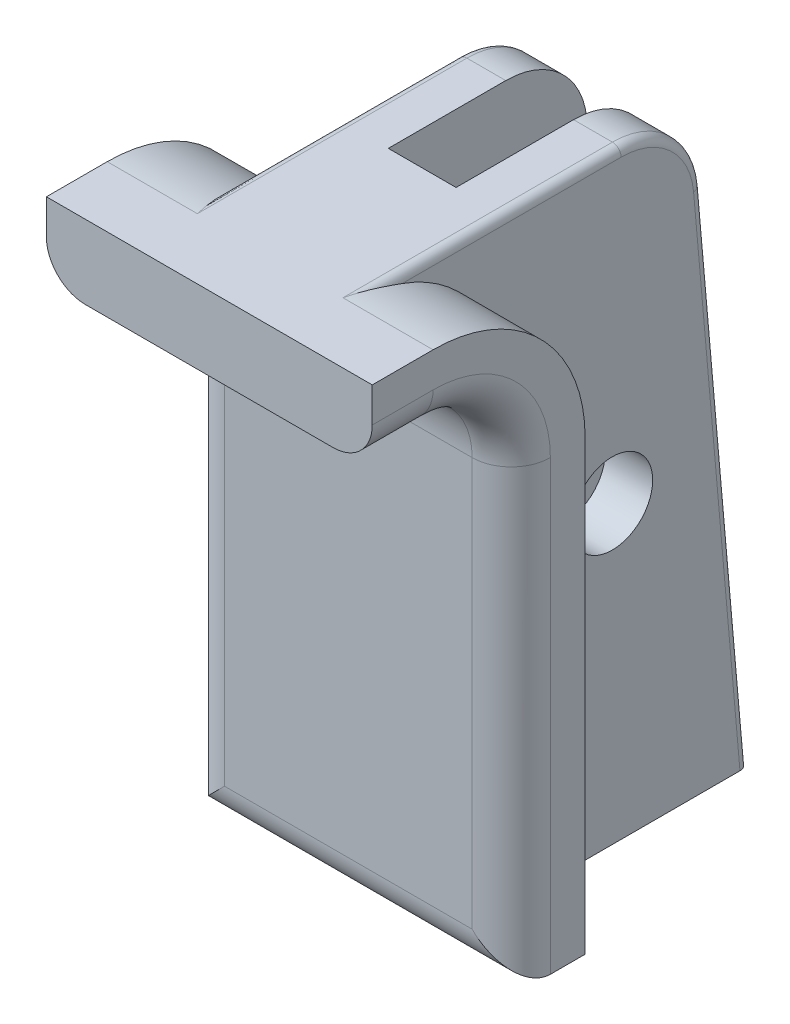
SolidWorks part; units mm, degrees
ref_plane "Front Plane" through (0, 0, 0) normal (0, 0, 1) x (1, 0, 0)
ref_plane "Top Plane" through (0, 0, 0) normal (0, 1, 0) x (1, 0, 0)
ref_plane "Right Plane" through (0, 0, 0) normal (1, 0, 0) x (0, 0, -1)
sketch "Sketch1" plane through (0, 0, 0) normal (1, 0, 0) x (0, 0, -1)
  line L0 (0, 0) -> (0, 17.526)
  line L1 (0, 0) -> (7.1628, 0)
  line L2 (5.8054, 15.3544) -> (7.1628, 0)
  line L3 (3.4334, 17.526) -> (0, 17.526)
  arc A0 (5.8054, 15.3544) -> (3.4334, 17.526) centre (3.4334, 15.1447) ccw
  point P7 (5.6134, 17.526)
  dimension "D4" = 2.3813
  dimension "D1" = 7.1628
  dimension "D2" = 17.526
  dimension "D3" = 5.6134
extrude "Boss-Extrude1" add sketch "Sketch1" along normal mid plane 4.7625
sketch "Sketch2" plane through (0, 0, 0) normal (1, 0, 0) x (0, 0, -1)
  line L0 (0, 17.526) -> (0, 0) construction
  line L1 (0, 13.081) -> (0, 0)
  line L2 (-2.159, 13.081) -> (-2.159, 0)
  line L3 (-2.159, 0) -> (0, 0)
  line L4 (-4.445, 17.526) -> (-6.223, 17.526)
  line L5 (-2.159, 17.526) -> (-2.159, 0) construction
  line L6 (-4.445, 15.367) -> (-6.223, 15.367)
  line L7 (0, 15.367) -> (-6.223, 15.367) construction
  line L8 (0, 17.526) -> (0, 0) construction
  line L9 (0, 17.526) -> (-6.223, 17.526) construction
  line L10 (-6.223, 17.526) -> (-6.223, 15.367)
  arc A0 (-2.159, 13.081) -> (-4.445, 15.367) centre (-4.445, 13.081) ccw
  arc A1 (0, 13.081) -> (-4.445, 17.526) centre (-4.445, 13.081) ccw
  dimension "D3" = 2.286
  dimension "D4" = 4.445
  dimension "D5" = 6.223
  dimension "D1" = 2.159
  dimension "D2" = 2.159
extrude "Boss-Extrude2" add sketch "Sketch2" along normal mid plane 9.525
sketch "Sketch3" plane through (0, 0, 0) normal (1, 0, 0) x (0, 0, -1)
  line L0 (0, 17.526) -> (0, 13.081) construction
  line L1 (0, 17.526) -> (0, 13.081)
  line L2 (0, 17.526) -> (-4.445, 17.526)
  arc A0 (0, 13.081) -> (-4.445, 17.526) centre (-4.445, 13.081) ccw construction
  arc A1 (0, 13.081) -> (-4.445, 17.526) centre (-4.445, 13.081) ccw
extrude "Boss-Extrude3" add sketch "Sketch3" along normal up to surface and the other way up to surface
fillet "Fillet1" radius 1.143 7 edges at (-4.7625, 15.367, 5.334) (-4.7625, 14.6974, 2.8286) (-4.7625, 6.5405, 2.159) (4.7625, 15.367, 5.334) (4.7625, 14.6974, 2.8286) (4.7625, 6.5405, 2.159) (0, 0, 2.159)
fillet "Fillet2" radius 0.254 6 edges at (-2.3813, 7.6772, -6.4841) (-2.3813, 16.9011, -5.0413) (2.3813, 7.6772, -6.4841) (2.3813, 16.9011, -5.0413) (-2.3812, 17.526, 0.5058) (2.3812, 17.526, 0.5058)
sketch "Sketch4" plane through (0, 0, 0) normal (0, -1, 0) x (1, 0, 0)
  line L0 (0, 0) -> (0, -13.5107) construction
  line L1 (-2.3812, 0) -> (-4.7625, 0) construction
  line L2 (0.9906, -10.4447) -> (-0.9906, -10.4447)
  line L3 (0.9906, -10.4447) -> (0.9906, 0)
  line L4 (0.9906, 0) -> (-0.9906, 0)
  line L5 (-0.9906, -10.4447) -> (-0.9906, 0)
  line L6 (0.9906, -10.4447) -> (-0.9906, 0) construction
  line L7 (0.9906, 0) -> (-0.9906, -10.4447) construction
  point P3 (0, -5.2224)
  dimension "D1" = 1.9812
extrude "Cut-Extrude1" cut sketch "Sketch4" against normal through all
sketch "Sketch5" plane through (2.3813, 0, 0) normal (1, 0, 0) x (0, 0, -1)
  line L0 (-4.445, 17.526) -> (3.4334, 17.526) construction
  line L1 (0, 17.526) -> (0, 0) construction
  circle A0 centre (3.175, 8.636) radius 1.1811
  dimension "D1" = 2.3622
  dimension "D2" = 8.89
  dimension "D3" = 3.175
extrude "Cut-Extrude2" cut sketch "Sketch5" against normal through all
equation "\".18750.100in\"=0.1"
